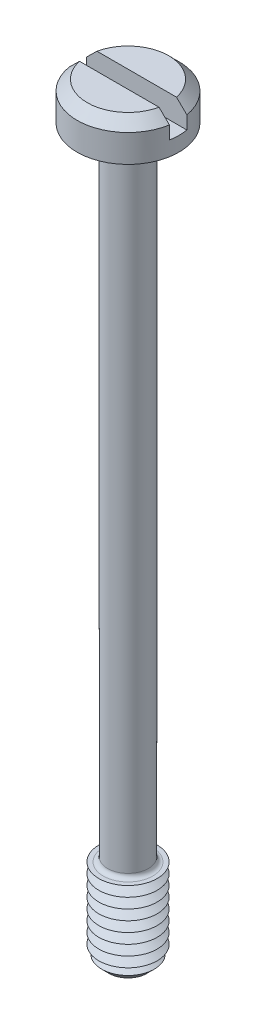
SolidWorks part; units mm, degrees
ref_plane "Front Plane" through (0, 0, 0) normal (0, 0, 1) x (1, 0, 0)
ref_plane "Top Plane" through (0, 0, 0) normal (0, 1, 0) x (1, 0, 0)
ref_plane "Right Plane" through (0, 0, 0) normal (1, 0, 0) x (0, 0, -1)
sketch "Sketch1" plane through (0, 0, 0) normal (0, 1, 0) x (1, 0, 0)
  circle A0 centre (0, 0) radius 3.5
  dimension "D1" = 7
extrude "Boss-Extrude1" add sketch "Sketch1" along normal blind 2.6
sketch "Sketch2" plane through (0, 0, 0) normal (0, -1, 0) x (1, 0, 0)
  circle A0 centre (0, 0) radius 1.4
  dimension "D1" = 2.8
extrude "Boss-Extrude2" add sketch "Sketch2" along normal blind 50
sketch "Sketch3" plane through (0, -50, 0) normal (0, -1, 0) x (1, 0, 0)
  circle A0 centre (0, 0) radius 2
  dimension "D1" = 4
extrude "Boss-Extrude3" add sketch "Sketch3" against normal blind 6
chamfer "Chamfer1" distance 0.7 angle 45 1 edges at (0, -50, -2)
sketch "Sketch4" plane through (0, 0, 0) normal (1, 0, 0) x (0, 0, -1)
  line L0 (0, -6.5871) -> (0, -12.0372) construction
sketch "Sketch5" plane through (0, 0, 0) normal (1, 0, 0) x (0, 0, -1)
  line L0 (-2, -44) -> (-1.3938, -44.35)
  line L1 (-1.3938, -44.35) -> (-2, -44.7)
  line L2 (-2, -44) -> (-2, -49.3) construction
  line L3 (-2, -44.7) -> (-2, -44)
  dimension "D1" = 0.7
revolve "Cut-Revolve1" cut sketch "Sketch5" angle 360 about L0
pattern_linear "LPattern1" count 8 spacing 0.7 along (0, -1, 0) of "Cut-Revolve1"
fillet "Fillet1" radius 0.3 2 edges at (0, -44, -1.4) (0, 0, -1.4)
chamfer "Chamfer2" distance 0.7 angle 45 1 edges at (0, 2.6, 3.5)
sketch "Sketch6" plane through (0, 2.6, 0) normal (0, 1, 0) x (1, 0, 0)
  line L1 (3.5, -0.6) -> (-3.5, -0.6)
  line L2 (3.5, -0.6) -> (3.5, 0.6)
  line L3 (3.5, 0.6) -> (-3.5, 0.6)
  line L4 (-3.5, -0.6) -> (-3.5, 0.6)
  line L5 (3.5, -0.6) -> (-3.5, 0.6) construction
  line L6 (3.5, 0.6) -> (-3.5, -0.6) construction
  circle A0 centre (0, 0) radius 3.5 construction
  point P0 (0, 0)
  dimension "D1" = 1.2
extrude "Cut-Extrude1" cut sketch "Sketch6" against normal blind 1.6
